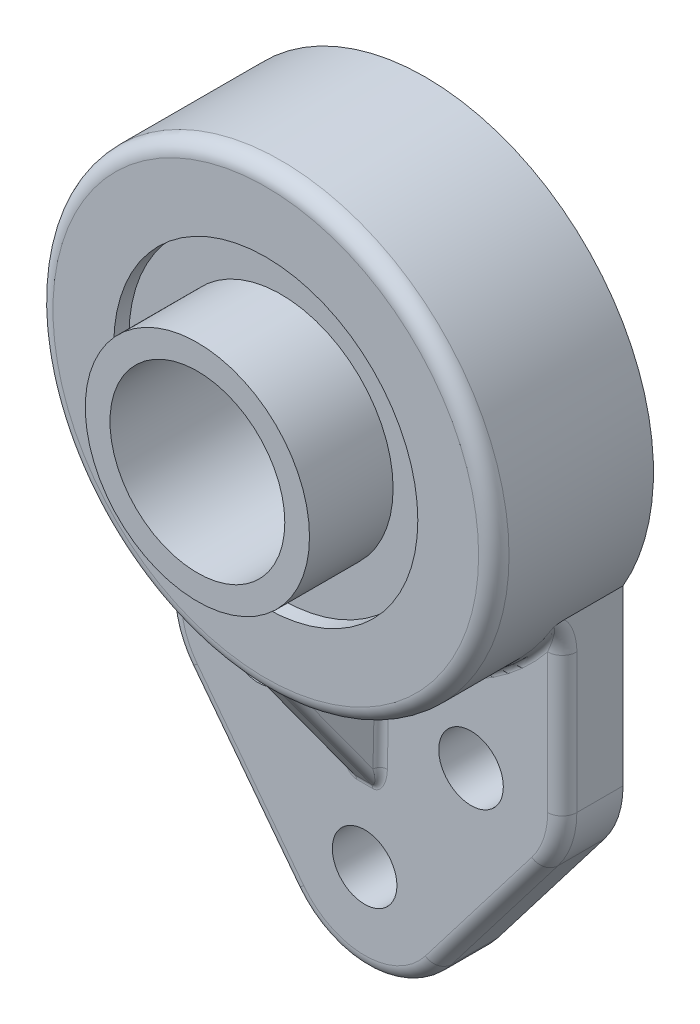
SolidWorks part; units mm, degrees
ref_plane "Plane1" through (0, 0, 0) normal (0, 0, 1) x (1, 0, 0)
ref_plane "Plane2" through (0, 0, 0) normal (0, 1, 0) x (1, 0, 0)
ref_plane "Plane3" through (0, 0, 0) normal (1, 0, 0) x (0, 0, -1)
sketch "Sketch1" plane through (0, 0, 0) normal (0, 0, 1) x (1, 0, 0)
  line L0 (0, 0) -> (0, -130.829) construction
  line L1 (15.1134, -100.4969) -> (37.3384, -71.5327)
  line L2 (41.275, -59.9358) -> (41.275, -23.7595)
  line L3 (-41.275, -59.9358) -> (-41.275, -23.7595)
  line L4 (-15.1134, -100.4969) -> (-37.3384, -71.5327)
  arc A0 (41.275, -23.7595) -> (-41.275, -23.7595) centre (0, 0) ccw
  arc A1 (-15.1134, -100.4969) -> (15.1134, -100.4969) centre (0, -88.9) ccw
  arc A2 (37.3384, -71.5327) -> (41.275, -59.9358) centre (22.225, -59.9358) ccw
  arc A3 (-37.3384, -71.5327) -> (-41.275, -59.9358) centre (-22.225, -59.9358) cw
  dimension "D1" = 95.25
  dimension "D5" = 19.05
  dimension "D2" = 37.5
  dimension "D3" = 82.55
  dimension "D4" = 155.575
extrude "Base-Extrude" add sketch "Sketch1" along normal blind 12.7
sketch "Sketch2" plane through (0, 0, 0) normal (0, 0, 1) x (1, 0, 0)
  circle A0 centre (0, 0) radius 47.625
  arc A1 (41.275, -23.7595) -> (-41.275, -23.7595) centre (0, 0) ccw construction
extrude "Boss-Extrude1" add sketch "Sketch2" along normal blind 33.3375
sketch "Sketch3" plane through (0, 0, 12.7) normal (0, 0, 1) x (1, 0, 0)
  circle A0 centre (-22.225, -59.9358) radius 6.7437
  circle A1 centre (0, -88.9) radius 6.7437
  circle A2 centre (22.225, -59.9358) radius 6.7437
  dimension "D1" = 13.4874
extrude "Cut-Extrude1" cut sketch "Sketch3" against normal through all
fillet "Fillet3" radius 3.175 1 edges at (47.625, 0, 33.3375)
sketch "Sketch4" plane through (0, 0, 0) normal (1, 0, 0) x (0, 0, -1)
  line L0 (-31.3843, -47.6721) -> (-12.7, -73.3778)
  line L1 (-12.7, -100.4969) -> (-12.7, -71.5327) construction
rib "Rib1" sketch "Sketch4" sketch "Sketch4" thickness 6.35 extrusion direction parallel to sketch draft on yes draft angle 2 parameters "D1"=6.35, "D3"=2
fillet "Fillet9" radius 1.524 7 edges at (-3.1868, -47.3404, 31.2092) (3.1868, -47.3404, 31.2092) (-3.175, -60.2055, 22.2744) (3.4598, -47.4992, 21.4291) (3.175, -60.2055, 22.2744) (-3.4598, -47.4992, 21.4291)
fillet "Fillet10" radius 1.524 7 edges at (-3.4666, -47.4987, 21.1879) (3.4666, -47.4987, 21.1879) (-2.3953, -47.288, 31.458) (2.2084, -47.2296, 31.5995)
sketch "Sketch5" plane through (0, 0, 33.3375) normal (0, 0, 1) x (1, 0, 0)
  circle A0 centre (0, 0) radius 31.75
  dimension "D1" = 63.5
extrude "Cut-Extrude2" cut sketch "Sketch5" against normal blind 3.175
sketch "Sketch6" plane through (0, 0, 0) normal (0, 0, 1) x (1, 0, 0)
  circle A0 centre (0, 0) radius 23.4156
  dimension "D1" = 46.8312
extrude "Boss-Extrude2" add sketch "Sketch6" along normal blind 47.625
sketch "Sketch7" plane through (0, 0, 47.625) normal (0, 0, 1) x (1, 0, 0)
  circle A0 centre (0, 0) radius 18.2562
  dimension "D1" = 36.5125
extrude "Cut-Extrude3" cut sketch "Sketch7" against normal through all
fillet "Fillet11" radius 1.524 11 edges at (4.1297, -47.7905, 12.7) (3.4526, -48.8652, 20.689) (25.9909, -39.9076, 12.7) (0, -73.3778, 12.7) (-3.4526, -59.8589, 12.7) (3.4526, -59.8589, 12.7) (-2.7619, -72.6503, 12.7) (2.7619, -72.6503, 12.7) (-25.9909, -39.9076, 12.7) (-4.822, -47.3803, 20.7105) (-4.0321, -47.8969, 12.7)
fillet "Fillet12" radius 3.048 9 edges at (40.264, -66.0592, 12.7) (41.275, -43.3096, 12.7) (-41.275, -24.1051, 13.5181) (41.275, -23.9758, 13.6599) (-41.275, -43.3096, 12.7) (-40.264, -66.0592, 12.7) (-26.2259, -86.0148, 12.7) (0, -107.95, 12.7) (26.2259, -86.0148, 12.7)
sketch "Sketch8" plane through (0, 0, 12.7) normal (0, 0, 1) x (1, 0, 0)
  line L0 (-15.1134, -100.4969) -> (-37.3384, -71.5327) construction
  line L1 (15.1134, -100.4969) -> (37.3384, -71.5327) construction
  circle A0 centre (0, -88.9) radius 6.7437
  dimension "D1" = 13.4874
  dimension "D2" = 19.05
  dimension "D3" = 19.05
extrude "Cut-Extrude4" [suppressed] cut sketch "Sketch8" against normal through all
pattern_linear "LPattern1" [suppressed] count 2 spacing 38.1 count 2 spacing 38.1
